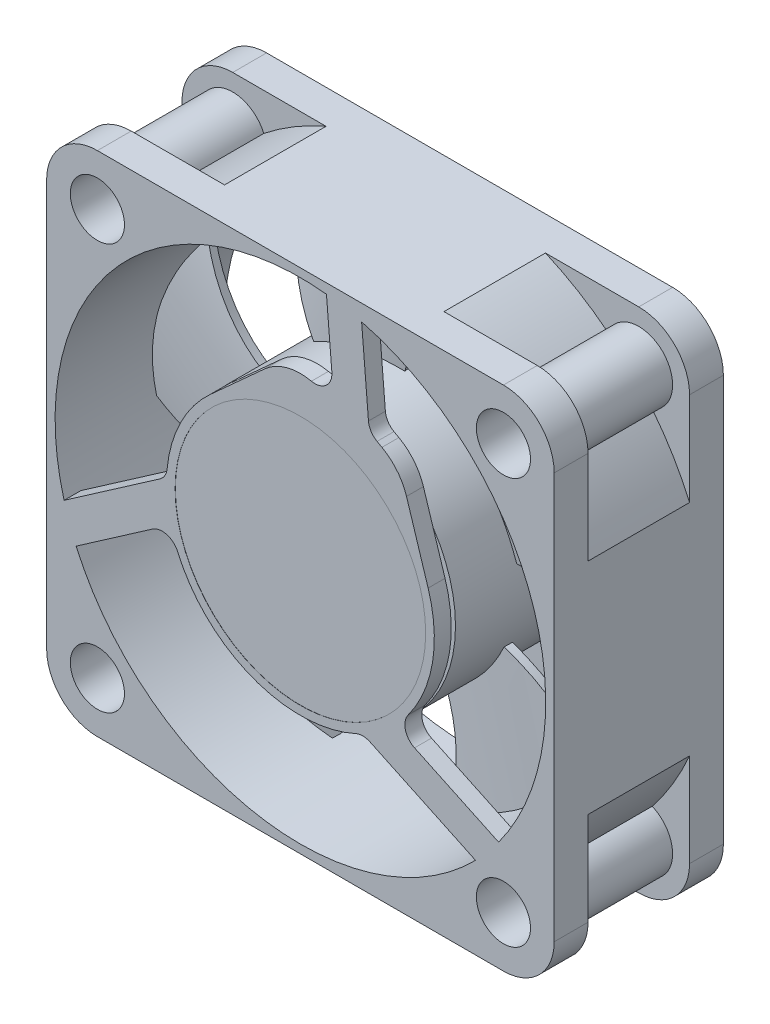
SolidWorks part; units mm, degrees
ref_plane "Front Plane" through (0, 0, 0) normal (0, 0, 1) x (1, 0, 0)
ref_plane "Top Plane" through (0, 0, 0) normal (0, 1, 0) x (1, 0, 0)
ref_plane "Right Plane" through (0, 0, 0) normal (1, 0, 0) x (0, 0, -1)
sketch "Sketch1" plane through (0, 0, 0) normal (0, 0, 1) x (1, 0, 0)
  line L1 (-15, -15) -> (15, -15)
  line L2 (-15, -15) -> (-15, 15)
  line L3 (-15, 15) -> (15, 15)
  line L4 (15, -15) -> (15, 15)
  line L5 (-15, -15) -> (15, 15) construction
  line L6 (-15, 15) -> (15, -15) construction
  point P0 (0, 0)
  dimension "D1" = 30
  dimension "D2" = 30
sketch "Sketch2" plane through (0, 0, 0) normal (0, 0, 1) x (1, 0, 0)
  line L0 (-15, 6.485) -> (-15, -6.485)
  line L1 (-6.485, -15) -> (6.485, -15)
  line L2 (15, -6.485) -> (15, 6.485)
  line L3 (6.485, 15) -> (-6.485, 15)
  arc A0 (-6.485, 15) -> (-15, 6.485) centre (0, 0) ccw
  arc A1 (-15, -6.485) -> (-6.485, -15) centre (0, 0) ccw
  arc A2 (6.485, -15) -> (15, -6.485) centre (0, 0) ccw
  arc A3 (15, 6.485) -> (6.485, 15) centre (0, 0) ccw
  circle A4 centre (0, 0) radius 14.5
  dimension "D1" = 29
extrude "Boss-Extrude1" add sketch "Sketch2" along normal mid plane 6
sketch "Sketch3" plane through (0, 0, 3) normal (0, 0, 1) x (1, 0, 0)
  line L4 (-6.485, -15) -> (6.485, -15)
  line L5 (15, -6.485) -> (15, 6.485)
  line L6 (6.485, 15) -> (-6.485, 15)
  line L7 (-15, 6.485) -> (-15, -6.485)
  line L8 (-6.485, -15) -> (6.485, -15)
  line L9 (15, -6.485) -> (15, 6.485)
  line L10 (6.485, 15) -> (-6.485, 15)
  line L11 (-15, 6.485) -> (-15, -6.485)
  arc A4 (-15, -6.485) -> (-6.485, -15) centre (0, 0) ccw
  arc A5 (6.485, -15) -> (15, -6.485) centre (0, 0) ccw
  arc A6 (15, 6.485) -> (6.485, 15) centre (0, 0) ccw
  arc A7 (-6.485, 15) -> (-15, 6.485) centre (0, 0) ccw
  arc A8 (-15, -6.485) -> (-6.485, -15) centre (0, 0) ccw
  arc A9 (6.485, -15) -> (15, -6.485) centre (0, 0) ccw
  arc A10 (15, 6.485) -> (6.485, 15) centre (0, 0) ccw
  arc A11 (-6.485, 15) -> (-15, 6.485) centre (0, 0) ccw
  dimension "D1" = 0
sketch "Sketch4" plane through (0, 0, 3) normal (0, 0, 1) x (1, 0, 0)
  line L0 (-15, -15) -> (-15, 15) construction
  line L1 (-15, 15) -> (15, 15) construction
  line L2 (15, -15) -> (15, 15) construction
  line L3 (-15, -15) -> (15, -15) construction
  line L12 (-15, -15) -> (-15, 15)
  line L13 (-15, 15) -> (15, 15)
  line L14 (15, -15) -> (15, 15)
  line L15 (-15, -15) -> (15, -15)
  circle A0 centre (0, 0) radius 14.5
  circle A1 centre (0, 0) radius 14.5 construction
extrude "Boss-Extrude2" add sketch "Sketch4" along normal blind 2
mirror "Mirror1" about plane through (0, 0, 0) normal (0, 0, 1) of "Boss-Extrude2"
fillet "Fillet1" radius 3 8 edges at (-15, -15, -4) (-15, -15, 4) (15, -15, -4) (15, -15, 4) (15, 15, -4) (15, 15, 4) (-15, 15, -4) (-15, 15, 4)
sketch "Sketch5" plane through (0, 0, 5) normal (0, 0, 1) x (1, 0, 0)
  circle A0 centre (-12, 12) radius 2
  circle A1 centre (12, 12) radius 2
  circle A2 centre (12, -12) radius 2
  circle A3 centre (-12, -12) radius 2
  dimension "D1" = 4
extrude "Boss-Extrude3" add sketch "Sketch5" against normal up to surface (8 mm away)
sketch "Sketch6" plane through (0, 0, 5) normal (0, 0, 1) x (1, 0, 0)
  circle A0 centre (-12, 12) radius 1.6
  circle A1 centre (12, 12) radius 1.6
  circle A2 centre (12, -12) radius 1.6
  circle A3 centre (-12, -12) radius 1.6
  dimension "D1" = 3.2
extrude "Cut-Extrude1" cut sketch "Sketch6" against normal through all
sketch "Sketch9" plane through (0, 0, 0) normal (0, 0, 1) x (1, 0, 0)
  line L0 (-13.9691, -3.8875) -> (-7.9096, 0.3162)
  line L1 (-13.2564, -5.8752) -> (-7.6608, -1.9933)
  line L2 (3.6179, 14.0414) -> (4.0667, 8.6407)
  line L3 (1.5401, 14.418) -> (1.9827, 9.0927)
  line L4 (10.3513, -10.1539) -> (3.6809, -7.008)
  line L5 (11.7163, -8.5428) -> (5.5567, -5.6378)
  line L6 (-5.3158, 5.8655) -> (-2.096, 8.7836)
  line L7 (7.5494, 2.3809) -> (6.2709, 6.4348)
  line L8 (1.0066, 9.4253) -> (1.9827, 9.0927)
  line L9 (4.8192, 8.2193) -> (4.0667, 8.6407)
  arc A0 (-7.6608, -1.9933) -> (3.6809, -7.008) centre (0, 0) ccw
  circle A1 centre (0, 0) radius 14.5 construction
  arc A2 (-5.3158, 5.8655) -> (-7.9096, 0.3162) centre (0, 0) ccw
  arc A3 (5.5567, -5.6378) -> (7.5494, 2.3809) centre (0, 0) ccw
  arc A4 (1.0066, 9.4253) -> (-2.096, 8.7836) centre (0, 6.4709) ccw
  arc A5 (1.5401, 14.418) -> (-13.9691, -3.8875) centre (0, 0) ccw
  arc A6 (6.2709, 6.4348) -> (4.8192, 8.2193) centre (3.2943, 5.496) ccw
  arc A7 (-13.2564, -5.8752) -> (10.3513, -10.1539) centre (0, 0) ccw
  arc A8 (11.7163, -8.5428) -> (3.6179, 14.0414) centre (0, 0) ccw
  dimension "D1" = 3
sketch "Sketch10" plane through (0, 0, 5) normal (0, 0, 1) x (1, 0, 0)
  line L4 (-15, 12) -> (-15, -12)
  line L5 (-12, -15) -> (12, -15)
  line L6 (15, -12) -> (15, 12)
  line L7 (12, 15) -> (-12, 15)
  line L8 (-15, 12) -> (-15, -12)
  line L9 (-12, -15) -> (12, -15)
  line L10 (15, -12) -> (15, 12)
  line L11 (12, 15) -> (-12, 15)
  arc A4 (-15, -12) -> (-12, -15) centre (-12, -12) ccw
  arc A5 (12, -15) -> (15, -12) centre (12, -12) ccw
  arc A6 (15, 12) -> (12, 15) centre (12, 12) ccw
  arc A7 (-12, 15) -> (-15, 12) centre (-12, 12) ccw
  arc A8 (-15, -12) -> (-12, -15) centre (-12, -12) ccw
  arc A9 (12, -15) -> (15, -12) centre (12, -12) ccw
  arc A10 (15, 12) -> (12, 15) centre (12, 12) ccw
  arc A11 (-12, 15) -> (-15, 12) centre (-12, 12) ccw
  dimension "D1" = 0
ref_plane "Plane1" through (0, 0, 5) normal (0, 0, 1) x (1, 0, 0)
sketch "Sketch12" plane through (0, 0, 5) normal (0, 0, 1) x (1, 0, 0)
  line L0 (1.5401, 14.418) -> (1.9827, 9.0927) construction
  line L1 (1.0066, 9.4253) -> (1.9827, 9.0927) construction
  line L2 (-5.3158, 5.8655) -> (-2.096, 8.7836) construction
  line L3 (-13.9691, -3.8875) -> (-7.9096, 0.3162) construction
  line L4 (-13.2564, -5.8752) -> (-7.6608, -1.9933) construction
  line L5 (10.3513, -10.1539) -> (3.6809, -7.008) construction
  line L6 (11.7163, -8.5428) -> (5.5567, -5.6378) construction
  line L7 (7.5494, 2.3809) -> (6.2709, 6.4348) construction
  line L8 (4.8192, 8.2193) -> (4.0667, 8.6407) construction
  line L9 (3.6179, 14.0414) -> (4.0667, 8.6407) construction
  line L10 (1.5401, 14.418) -> (1.9827, 9.0927)
  line L11 (1.0066, 9.4253) -> (1.9827, 9.0927)
  line L12 (-5.3158, 5.8655) -> (-2.096, 8.7836)
  line L13 (-13.9691, -3.8875) -> (-7.9096, 0.3162)
  line L14 (-13.2564, -5.8752) -> (-7.6608, -1.9933)
  line L15 (10.3513, -10.1539) -> (3.6809, -7.008)
  line L16 (11.7163, -8.5428) -> (5.5567, -5.6378)
  line L17 (7.5494, 2.3809) -> (6.2709, 6.4348)
  line L18 (4.8192, 8.2193) -> (4.0667, 8.6407)
  line L19 (3.6179, 14.0414) -> (4.0667, 8.6407)
  arc A0 (1.5401, 14.418) -> (-13.9691, -3.8875) centre (0, 0) ccw construction
  arc A1 (1.0066, 9.4253) -> (-2.096, 8.7836) centre (0, 6.4709) ccw construction
  arc A2 (-5.3158, 5.8655) -> (-7.9096, 0.3162) centre (0, 0) ccw construction
  arc A3 (-13.2564, -5.8752) -> (10.3513, -10.1539) centre (0, 0) ccw construction
  arc A4 (-7.6608, -1.9933) -> (3.6809, -7.008) centre (0, 0) ccw construction
  arc A5 (11.7163, -8.5428) -> (3.6179, 14.0414) centre (0, 0) ccw construction
  arc A6 (5.5567, -5.6378) -> (7.5494, 2.3809) centre (0, 0) ccw construction
  arc A7 (6.2709, 6.4348) -> (4.8192, 8.2193) centre (3.2943, 5.496) ccw construction
  arc A8 (1.5401, 14.418) -> (-13.9691, -3.8875) centre (0, 0) ccw
  arc A9 (1.0066, 9.4253) -> (-2.096, 8.7836) centre (0, 6.4709) ccw
  arc A10 (-5.3158, 5.8655) -> (-7.9096, 0.3162) centre (0, 0) ccw
  arc A11 (-13.2564, -5.8752) -> (10.3513, -10.1539) centre (0, 0) ccw
  arc A12 (-7.6608, -1.9933) -> (3.6809, -7.008) centre (0, 0) ccw
  arc A13 (11.7163, -8.5428) -> (3.6179, 14.0414) centre (0, 0) ccw
  arc A14 (5.5567, -5.6378) -> (7.5494, 2.3809) centre (0, 0) ccw
  arc A15 (6.2709, 6.4348) -> (4.8192, 8.2193) centre (3.2943, 5.496) ccw
  circle A16 centre (0, 0) radius 14.7604
extrude "Boss-Extrude4" add sketch "Sketch12" against normal blind 1
mirror "Mirror2" about plane through (0, 0, 0) normal (0, 0, 1) of "Boss-Extrude4"
fillet "Fillet2" radius 1 12 edges at (4.0667, 8.6407, -4.5) (1.9827, 9.0927, -4.5) (-7.9096, 0.3162, -4.5) (-7.6608, -1.9933, -4.5) (3.6809, -7.008, -4.5) (5.5567, -5.6378, -4.5) (5.5567, -5.6378, 4.5) (3.6809, -7.008, 4.5) (-7.6608, -1.9933, 4.5) (-7.9096, 0.3162, 4.5) (1.9827, 9.0927, 4.5) (4.0667, 8.6407, 4.5)
sketch "Sketch13" plane through (0, 0, 5) normal (0, 0, 1) x (1, 0, 0)
  circle A0 centre (0, 0) radius 2.2627
extrude "Boss-Extrude5" add sketch "Sketch13" against normal up to surface (10 mm away)
sketch "Sketch14" plane through (0, 0, 0) normal (0, 0, 1) x (1, 0, 0)
  circle A0 centre (0, 0) radius 7.9159
extrude "Boss-Extrude6" add sketch "Sketch14" along normal mid plane 7.5
sketch "Sketch15" plane through (0, 0, 0) normal (0, 0, 1) x (1, 0, 0)
  circle A0 centre (0, 0) radius 7.9159 construction
  arc A1 (7.3807, 1.2628) -> (4.9955, 5.5779) centre (0, 0) ccw
  arc A2 (13.6923, -0.5973) -> (10.4963, 8.8127) centre (0, 0) ccw
  spline S0 degree 3 poles (10.4963, 8.8127) (7.9769, 8.5842) (6.1606, 7.071) (4.9955, 5.5779) knots 0.011736 0.011736 0.011736 0.011736 0.768136 0.768136 0.768136 0.768136
  spline S1 degree 3 poles (13.6923, -0.5973) (11.7121, 0.8836) (9.6083, 1.5037) (7.3807, 1.2628) knots 0.001824 0.001824 0.001824 0.001824 0.835124 0.835124 0.835124 0.835124
extrude "Boss-Extrude7" add sketch "Sketch15" along normal mid plane 0.5 separate body
other "Flex1" parameters "D0"=23, "D1"=0, "D2"=0
pattern_circular "CirPattern1" count 5 over 360 about axis through (0, 0, 3.75) along (0, 0, -1)
combine bodies "Combine1" operation type add bodies to combine 109 111 112 113 114 115
sketch "Sketch16" plane through (0, 0, 5) normal (0, 0, 1) x (1, 0, 0)
  circle A0 centre (0, 0) radius 7.4041
extrude "Cut-Extrude2" cut sketch "Sketch16" against normal blind 0.01
mirror "Mirror3" about plane through (0, 0, 0) normal (0, 0, 1) of "Cut-Extrude2"
